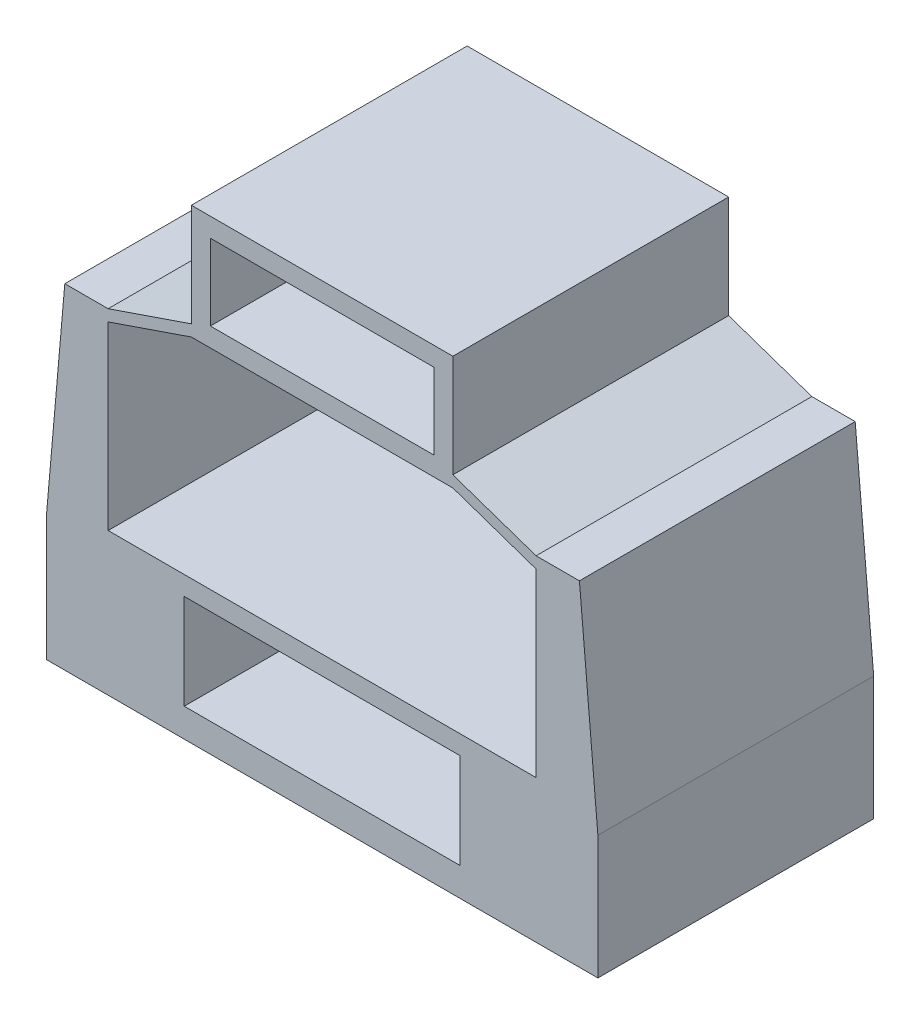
SolidWorks part; units mm, degrees
ref_plane "前视基准面" through (0, 0, 0) normal (0, 0, 1) x (1, 0, 0)
ref_plane "上视基准面" through (0, 0, 0) normal (0, 1, 0) x (1, 0, 0)
ref_plane "右视基准面" through (0, 0, 0) normal (1, 0, 0) x (0, 0, -1)
sketch "Model" plane through (0, 0, 0) normal (0, 0, 1) x (1, 0, 0)
  line L0 (0, 0) -> (0, 0.6)
  line L1 (0, 0.6) -> (-2.9, 0.6)
  line L2 (-2.9, 0.6) -> (-2.9, 2.6)
  line L3 (-2.9, 2.6) -> (0, 2.6)
  line L4 (0, 2.6) -> (0, 3)
  line L5 (0, 3) -> (-4.5, 3)
  line L6 (-4.5, 3) -> (-4.5, 6.8)
  line L7 (-4.5, 6.8) -> (-2.75, 7.4)
  line L8 (-2.75, 7.4) -> (0, 7.4)
  line L9 (0, 7.4) -> (0, 7.8)
  line L10 (0, 7.8) -> (-2.35, 7.8)
  line L11 (-2.35, 7.8) -> (-2.35, 9.4)
  line L12 (-2.35, 9.4) -> (0, 9.4)
  line L13 (0, 9.4) -> (0, 9.8)
  line L14 (0, 9.8) -> (-2.75, 9.8)
  line L15 (-2.75, 9.8) -> (-2.75, 7.64)
  line L16 (-2.75, 7.64) -> (-4.5, 7.04)
  line L17 (-4.5, 7.04) -> (-5.4116, 7.04)
  line L18 (-5.4116, 7.04) -> (-5.8, 2.6)
  line L19 (-5.8, 2.6) -> (-5.8, 0)
  line L20 (-5.8, 0) -> (0, 0)
  dimension "D1" = 0.6
  dimension "D2" = 2
  dimension "D3" = 2.9
  dimension "D4" = 0.4
  dimension "D5" = 4.4
  dimension "D6" = 0.4
  dimension "D7" = 2.35
  dimension "D8" = 1.6
  dimension "D9" = 0.4
  dimension "D10" = 0.4
  dimension "D11" = 0.24
  dimension "D12" = 5.8
  dimension "D13" = 4.5
  dimension "D14" = 85
  dimension "D15" = 3.8
extrude "凸台-拉伸1" add sketch "Model" along normal blind 5.8
ref_plane "基准面4" through (0, 0, 0) normal (1, 0, 0) x (0, 0, -1)
mirror "镜向1" about plane through (0, 0, 0) normal (1, 0, 0) of "凸台-拉伸1"
